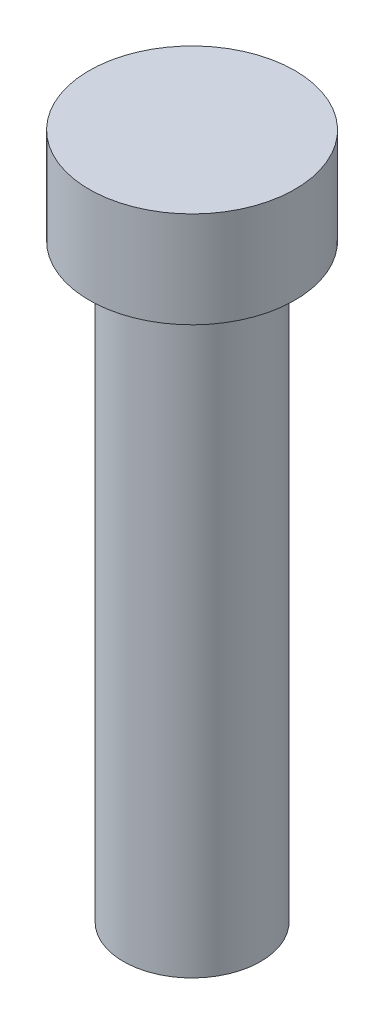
SolidWorks part; units mm, degrees
ref_plane "Front Plane" through (0, 0, 0) normal (0, 0, 1) x (1, 0, 0)
ref_plane "Top Plane" through (0, 0, 0) normal (0, 1, 0) x (1, 0, 0)
ref_plane "Right Plane" through (0, 0, 0) normal (1, 0, 0) x (0, 0, -1)
sketch "Sketch1" plane through (0, 0, 0) normal (0, 0, 1) x (1, 0, 0)
  line L0 (0, 0) -> (0, 68.236) construction
  line L1 (0, 0) -> (5, 0)
  line L2 (5, 0) -> (5, 43)
  line L3 (5, 43) -> (7.5, 43)
  line L4 (7.5, 43) -> (7.5, 50)
  line L5 (7.5, 50) -> (0, 50)
  line L6 (0, 50) -> (0, 0)
  dimension "D1" = 15
  dimension "D2" = 10
  dimension "D3" = 7
  dimension "D4" = 50
revolve "Revolve1" add sketch "Sketch1" angle 360 about L0
